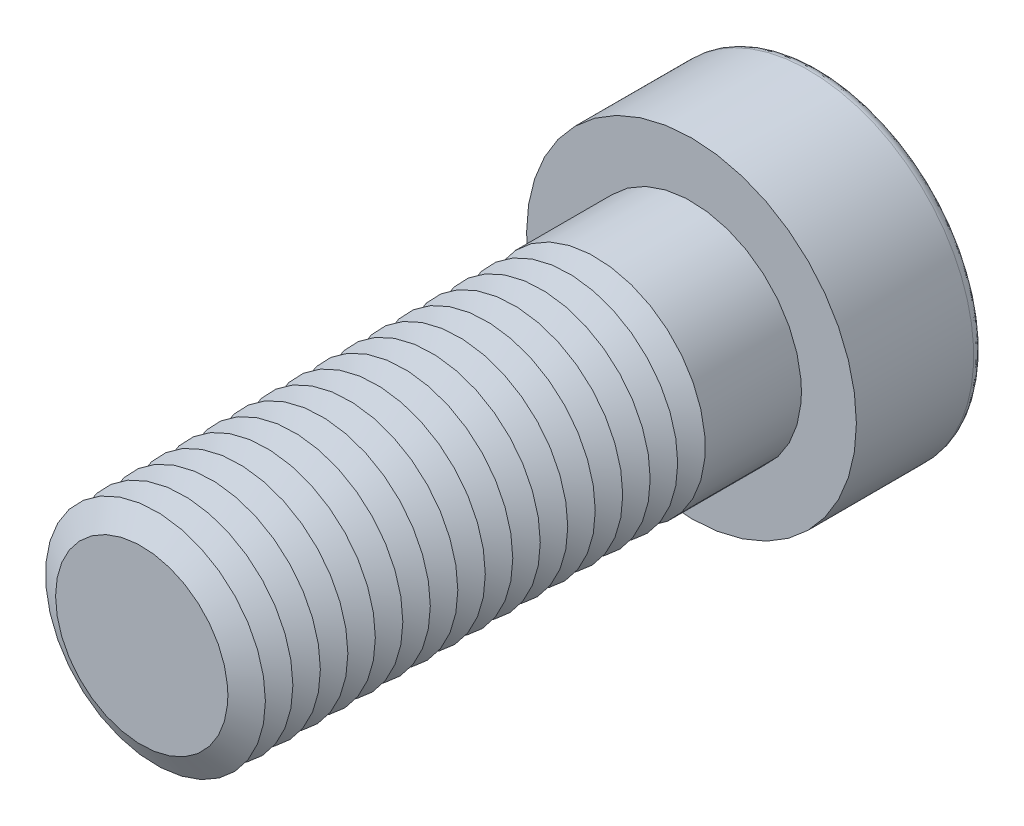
SolidWorks part; units mm, degrees
ref_plane "Front Plane" through (0, 0, 0) normal (0, 0, 1) x (1, 0, 0)
ref_plane "Top Plane" through (0, 0, 0) normal (0, 1, 0) x (1, 0, 0)
ref_plane "Right Plane" through (0, 0, 0) normal (1, 0, 0) x (0, 0, -1)
sketch "Sketch1" plane through (0, 0, 0) normal (0, 0, 1) x (1, 0, 0)
  circle A0 centre (0, 0) radius 12
  dimension "D1" = 24
extrude "Boss-Extrude1" add sketch "Sketch1" along normal blind 60
sketch "Sketch2" plane through (0, 0, 0) normal (0, 0, -1) x (-1, 0, 0)
  circle A0 centre (0, 0) radius 18
  dimension "D1" = 36
extrude "Boss-Extrude2" add sketch "Sketch2" along normal blind 14
sketch "Sketch3" plane through (0, 0, -14) normal (0, 0, -1) x (-1, 0, 0)
  line L1 (-5.4848, 9.5) -> (-10.9697, 0)
  line L2 (-10.9697, 0) -> (-5.4848, -9.5)
  line L3 (-5.4848, -9.5) -> (5.4848, -9.5)
  line L4 (5.4848, -9.5) -> (10.9697, 0)
  line L5 (10.9697, 0) -> (5.4848, 9.5)
  line L6 (5.4848, 9.5) -> (-5.4848, 9.5)
  circle A0 centre (0, 0) radius 9.5 construction
  dimension "D1" = 19
extrude "Cut-Extrude1" cut sketch "Sketch3" against normal blind 14.25
fillet "Fillet1" radius 1.2 1 edges at (-18, 0, -14)
sketch "Sketch4" plane through (0, 0, 0.25) normal (0, 0, -1) x (-1, 0, 0)
  line L0 (5.4848, -9.5) -> (10.9697, 0) construction
  circle A0 centre (0, 0) radius 9.5
extrude "Cut-Extrude2" cut sketch "Sketch4" against normal through all draft 60
sketch "Sketch5" plane through (0, 0, -14) normal (0, 0, -1) x (-1, 0, 0)
  circle A0 centre (0, 0) radius 10.9697
extrude "Cut-Extrude3" cut sketch "Sketch5" against normal through all draft 75
sketch "Sketch7" plane through (0, 0, 0) normal (1, 0, 0) x (0, 0, -1)
  line L25 (-60, 9.4019) -> (-58.5, 12)
  line L26 (-60, 12) -> (-60, -12) construction
  line L27 (-58.5, 12) -> (-61.5, 12)
  line L28 (-61.5, 12) -> (-60, 9.4019)
  line L29 (0, 12) -> (-60, 12) construction
  dimension "D1" = 3
revolve "Cut-Revolve1" cut sketch "Sketch7" angle 360 about axis through (0, 0, 60) along (0, 0, -1)
pattern_linear "LPattern1" count 17 spacing 3 along (0, 0, -1) of "Cut-Revolve1"
